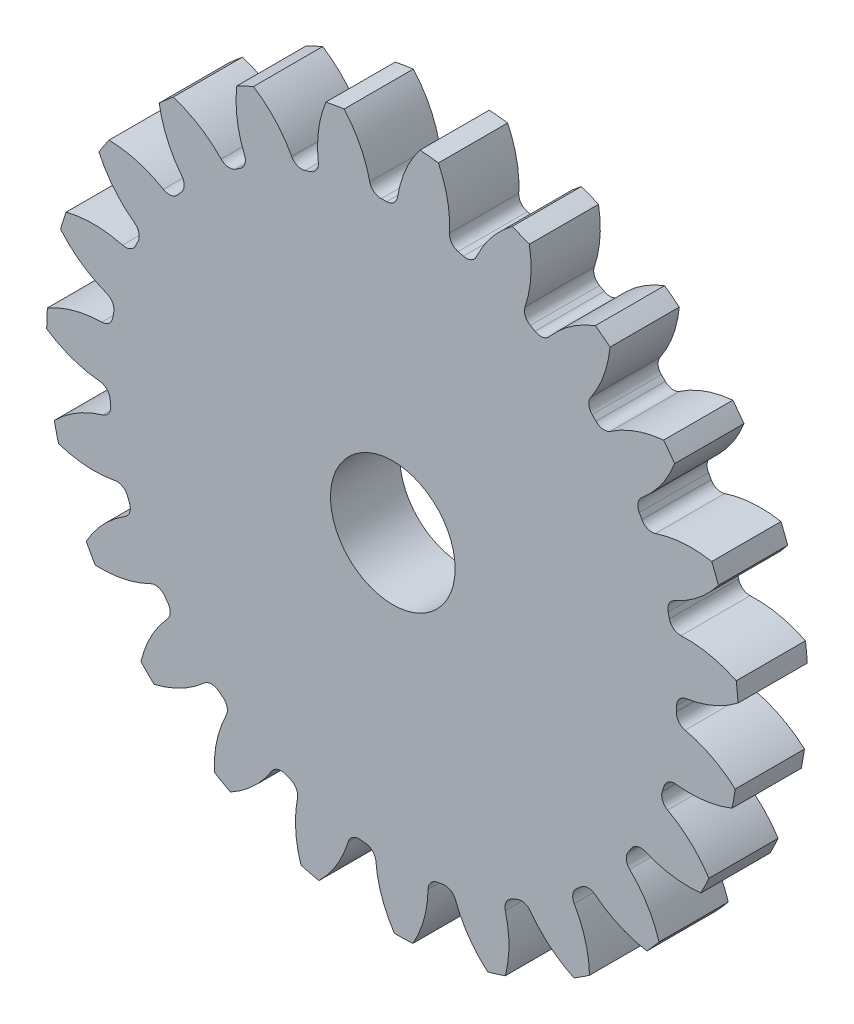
SolidWorks part; units mm, degrees
ref_plane "Front" through (0, 0, 0) normal (0, 0, 1) x (1, 0, 0)
ref_plane "Top" through (0, 0, 0) normal (0, 1, 0) x (1, 0, 0)
ref_plane "Right" through (0, 0, 0) normal (1, 0, 0) x (0, 0, -1)
sketch "Sketch3" plane through (0, 0, 0) normal (0, 0, 1) x (1, 0, 0)
  circle A0 centre (0, 0) radius 635
  dimension "od" = 1270
extrude "gearBody" add sketch "Sketch3" along normal blind 127
sketch "Sketch2" plane through (0, 0, 0) normal (0, 0, 1) x (1, 0, 0)
  line L0 (0, 0) -> (507.1807, 210.0811) construction
  line L1 (629.7397, -94.3988) -> (0, 0) construction
  line L2 (0, 0) -> (36.3143, 0) construction
  line L3 (583.921, 18.0535) -> (580.9823, -61.2312) construction
  line L5 (582.4516, -21.5888) -> (0, 0) construction
  line L7 (0, 0) -> (548.9684, 0) construction
  arc A0 (548.9166, 7.5428) -> (546.852, -48.1579) centre (0, 0) ccw construction
  arc A1 (633.3163, 46.2108) -> (628.1576, -92.9679) centre (0, 0) ccw construction
  arc A2 (583.921, 18.0535) -> (580.9823, -61.2312) centre (0, 0) ccw construction
  arc A3 (520.1325, -24.304) -> (520.5045, -14.2676) centre (0, 0) ccw
  arc A4 (629.7397, -94.3988) -> (536.191, -45.4277) centre (490.2369, -247.0509) ccw
  arc A5 (629.7397, -94.3988) -> (635, 47.5207) centre (0, 0) ccw
  arc A6 (635, 47.5207) -> (538.0827, 5.6093) centre (507.1807, 210.0811) cw
  arc A7 (520.5045, -14.2676) -> (538.0827, 5.6093) centre (541.1723, -14.8342) cw
  arc A8 (536.191, -45.4277) -> (520.1325, -24.304) centre (540.7856, -25.2691) cw
  point P6 (635, 47.5207)
  point P22 (629.7397, -94.3988)
  dimension "baseDia" = 1097.9369
  dimension "od" = 1270
  dimension "pd" = 1168.4
  dimension "rd" = 1041.4
  dimension "rFillet" = 20.6756
  dimension "pointX" = 635
  dimension "pointY" = 47.5207
  dimension "CTT" = 79.2847
  dimension "flankCenterAngle" = 22.5
extrude "toothCut" cut sketch "Sketch2" along normal through all
pattern_circular "CirPattern1" count 23 over 360 about axis through (0, 0, 0) along (0, 0, 1) of "toothCut"
sketch "hub1Dia" plane through (0, 0, 0) normal (0, 0, -1) x (-1, 0, 0)
  circle A0 centre (0, 0) radius 12.7
  dimension "hub1Dia" = 25.4
sketch "hub2Dia" plane through (0, 0, 127) normal (0, 0, 1) x (1, 0, 0)
  circle A0 centre (0, 0) radius 12.7
  dimension "hub2dia" = 25.4
sketch "boreDia" plane through (0, 0, 0) normal (0, 0, 1) x (1, 0, 0)
  circle A0 centre (0, 0) radius 114.3
  dimension "boreDia" = 228.6
extrude "bore" cut sketch "boreDia" against normal mid plane 25400
